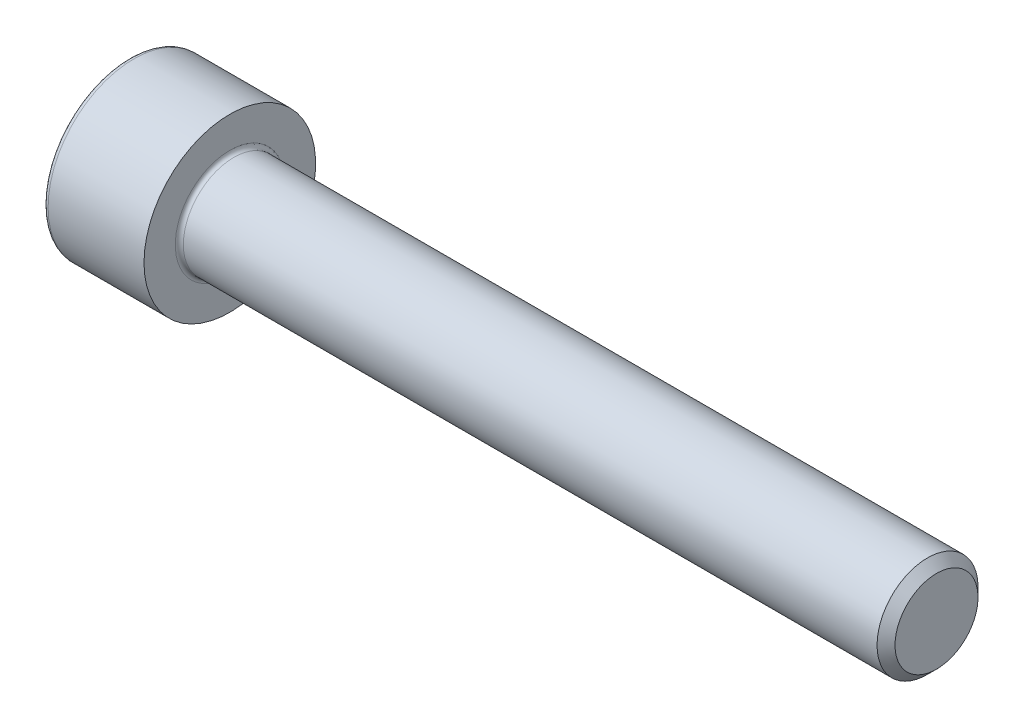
SolidWorks part; units mm, degrees
ref_plane "Plane1" through (0, 0, 0) normal (0, 0, 1) x (1, 0, 0)
ref_plane "Plane2" through (0, 0, 0) normal (0, 1, 0) x (1, 0, 0)
ref_plane "Plane3" through (0, 0, 0) normal (1, 0, 0) x (0, 0, -1)
revolve "Base-Revolve" add sketch "BodySke"
sketch "BodySke" plane through (0, 0, 0) normal (0, 0, 1) x (1, 0, 0)
  line L0 (0, 0) -> (0, 4.25)
  line L1 (0, 4.25) -> (5, 4.25)
  line L2 (5, 4.25) -> (5, 2.5)
  line L3 (5, 2.5) -> (39.555, 2.5)
  line L4 (40, 2.055) -> (40, 0)
  line L5 (40, 0) -> (0, 0)
  line L6 (-31.75, 0) -> (127, 0) construction
  line L8 (40, 2.055) -> (39.555, 2.5)
  line L10 (40, -2.055) -> (39.555, -2.5) construction
  line L11 (5.8, 9.525) -> (5.8, 3.175) construction
  line L12 (18, 9.525) -> (18, 3.175) construction
  line L13 (-20, 9.525) -> (-20, 3.175) construction
  dimension "Diameter" = 5
  dimension "Head_ht" = 5
  dimension "Length" = 35
  dimension "Body_ch_ang" = 45
  dimension "Head_dia" = 8.5
  dimension "Minor_dia" = 4.11
  dimension "Advance" = 0.8
  dimension "Thread_nom" = 22
  dimension "Thread_length" = 60
fillet "Fillet1" radius 0.2 1 edges at (5, 0, 2.5)
fillet "Fillet2" radius 0.25 1 edges at (0, 0, 4.25)
sketch "Sketch2" plane through (0, 0, 0) normal (0, 0, 1) x (1, 0, 0)
  line L0 (0, 2.042) -> (2.5, 2.042)
  line L1 (2.5, 2.042) -> (3.6789, 0)
  line L2 (-31.75, 0) -> (127, 0) construction
  line L3 (3.6789, 0) -> (0, 0)
  line L4 (0, 0) -> (0, 2.042)
  line L6 (0, 0) -> (47.625, 0) construction
  dimension "D1" = 2.042
  dimension "D2" = 60
  dimension "Depth" = 2.5
revolve "Hex-PreBroach" cut sketch "Sketch2" angle 360 about L6
sketch "Sketch3" plane through (0, 0, 0) normal (-1, 0, 0) x (0, 0.5, 0.866)
  line L0 (1.1789, 2.042) -> (-1.1789, 2.042)
  line L1 (-1.1789, 2.042) -> (-2.3579, 0)
  line L2 (1.1789, 2.042) -> (2.3579, 0)
  line L3 (1.1789, -2.042) -> (2.3579, 0)
  line L4 (1.1789, -2.042) -> (-1.1789, -2.042)
  line L5 (-1.1789, -2.042) -> (-2.3579, 0)
  dimension "D1" = 2.042
  dimension "D2" = 2.042
  dimension "Hex_size" = 4.084
extrude "Hex" cut sketch "Sketch3" against normal blind 2.5
sketch "ThdSchSke" plane through (0, 0, 0) normal (0, 0, 1) x (1, 0, 0)
  line L0 (18, -2.055) -> (17.6884, -2.5)
  line L1 (18, -2.055) -> (18.3116, -2.5)
  line L2 (18.3116, -2.5) -> (18.3116, -3.125)
  line L3 (-3.175, 0) -> (5.1513, 0) construction
  line L4 (0, 4) -> (0, -4) construction
  line L5 (18.3116, -3.125) -> (17.6884, -3.125)
  line L6 (17.6884, -3.125) -> (17.6884, -2.5)
  dimension "Thread_minor" = 4.11
  dimension "Diameter" = 5
  dimension "Start" = 18
  dimension "SideAngle" = 55
  dimension "VeeAngle" = 70
  dimension "Overcut" = 6.25
revolve "ThreadSchematic" [suppressed] cut sketch "ThdSchSke" angle 360 about L3
pattern_linear "ThdSchPat" [suppressed]
equation "\"D2@Sketch3\" = \"Hex_size@Sketch3\" / 2"
equation "\"D1@Sketch3\" = \"Hex_size@Sketch3\" / 2"
equation "\"D1@Sketch2\" = \"Hex_size@Sketch3\" / 2"
equation "\"Thread_minor@ThreadCosmetic\"  =  \"Minor_dia@BodySke\""
equation "\"Depth@Sketch2\" =  \"Key_eng@Hex\""
equation "\"Thread_length@ThreadCosmetic\" = ((sgn( (\"Length@BodySke\" - \"Advance@BodySke\" * 3.0) - \"Thread_nom@BodySke\" )-1)*( (\"Length@BodySke\" - \"Advance@BodySke\" * 3.0) - \"Thread_nom@BodySke\" ))/-2+ \"Thread_no"
equation "\"Thread_minor@ThdSchSke\" = \"Minor_dia@BodySke\""
equation "\"Diameter@ThdSchSke\" = \"Diameter@BodySke\""
equation "\"Overcut@ThdSchSke\" = \"Diameter@BodySke\" * 1.25"
equation "\"Start@ThdSchSke\" = \"Head_ht@BodySke\" + \"Length@BodySke\" - \"Thread_length@ThreadCosmetic\"  '---Non-countersunk---"
equation "\"Num_threads@ThdSchPat\" = int( \"Thread_length@ThreadCosmetic\" / \"Advance@BodySke\" + 0.999 )  + 1"
equation "\"Advance@ThdSchPat\" = \"Thread_length@ThreadCosmetic\" /  (\"Num_threads@ThdSchPat\" - 1) 'relax it"
equation "\"Num_threads@ThdSchPat\" = \"Num_threads@ThdSchPat\" - sgn( \"Num_threads@ThdSchPat\" - 1) '---chamfered tips only---"
